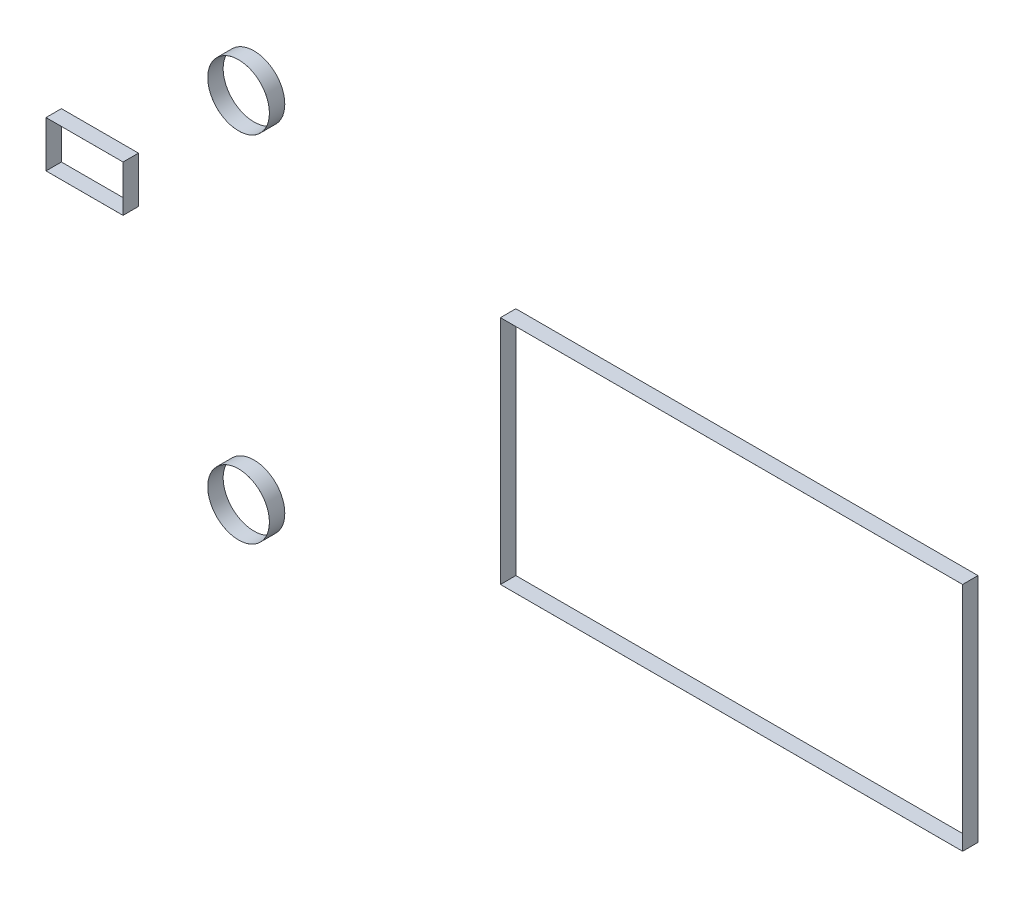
SolidWorks part; units mm, degrees
ref_plane "Plan XY" through (0, 0, 0) normal (0, 0, 1) x (1, 0, 0)
ref_plane "Plan XZ" through (0, 0, 0) normal (0, 1, 0) x (1, 0, 0)
ref_plane "Plan YZ" through (0, 0, 0) normal (1, 0, 0) x (0, 0, -1)
other "Centre de masse"
sketch "2 postes + pilotes" plane through (0, 0, 0) normal (0, 0, 1) x (1, 0, 0)
  line L0 (2.5, 10) -> (7.5, 10) construction
  line L1 (0, 0) -> (30, 0)
  line L2 (0, 0) -> (0, 15)
  line L3 (0, 15) -> (30, 15)
  line L4 (30, 0) -> (30, 15)
  line L5 (2.5, 11.5) -> (7.5, 11.5) construction
  line L6 (2.5, 11.5) -> (2.5, 8.5) construction
  line L7 (2.5, 8.5) -> (7.5, 8.5) construction
  line L8 (7.5, 11.5) -> (7.5, 8.5) construction
  line L9 (5, 11.5) -> (5, 8.5) construction
  line L10 (-27, 11.5) -> (-27, 8.5) construction
  line L11 (-29.5, 11.5) -> (-24.5, 11.5)
  line L12 (-29.5, 11.5) -> (-29.5, 8.5)
  line L13 (-29.5, 8.5) -> (-24.5, 8.5)
  line L14 (-24.5, 11.5) -> (-24.5, 8.5)
  line L15 (-32, 15) -> (-2, 15) construction
  line L16 (-32, 15) -> (-32, 0) construction
  line L17 (-32, 0) -> (-2, 0) construction
  line L18 (-2, 15) -> (-2, 0) construction
  line L19 (-29.5, 10) -> (-24.5, 10) construction
  line L20 (-32, 7.5) -> (-42.1578, 7.5) construction
  line L21 (-17, 15) -> (-17, 0) construction
  circle A0 centre (-17, 19) radius 2
  circle A1 centre (-17, -4) radius 2
  dimension "D12" = 4
  dimension "D1" = 30
  dimension "D2" = 15
  dimension "D3" = 5
  dimension "D4" = 3
  dimension "D5" = 10
  dimension "D6" = 5
  dimension "D7" = 5
  dimension "D8" = 2
  dimension "D9" = 5
  dimension "D10" = 30
  dimension "D11" = 32
  dimension "D13" = 4
extrude "Extru.-Mince1" add sketch "2 postes + pilotes" along normal blind 1 thin
other "Point de référence du centre de masse1"
equation "\"D10@2 postes + pilotes\"= \"D1@2 postes + pilotes\""
equation "\"D7@2 postes + pilotes\"= \"D3@2 postes + pilotes\""
equation "\"D9@2 postes + pilotes\"= \"D6@2 postes + pilotes\""
